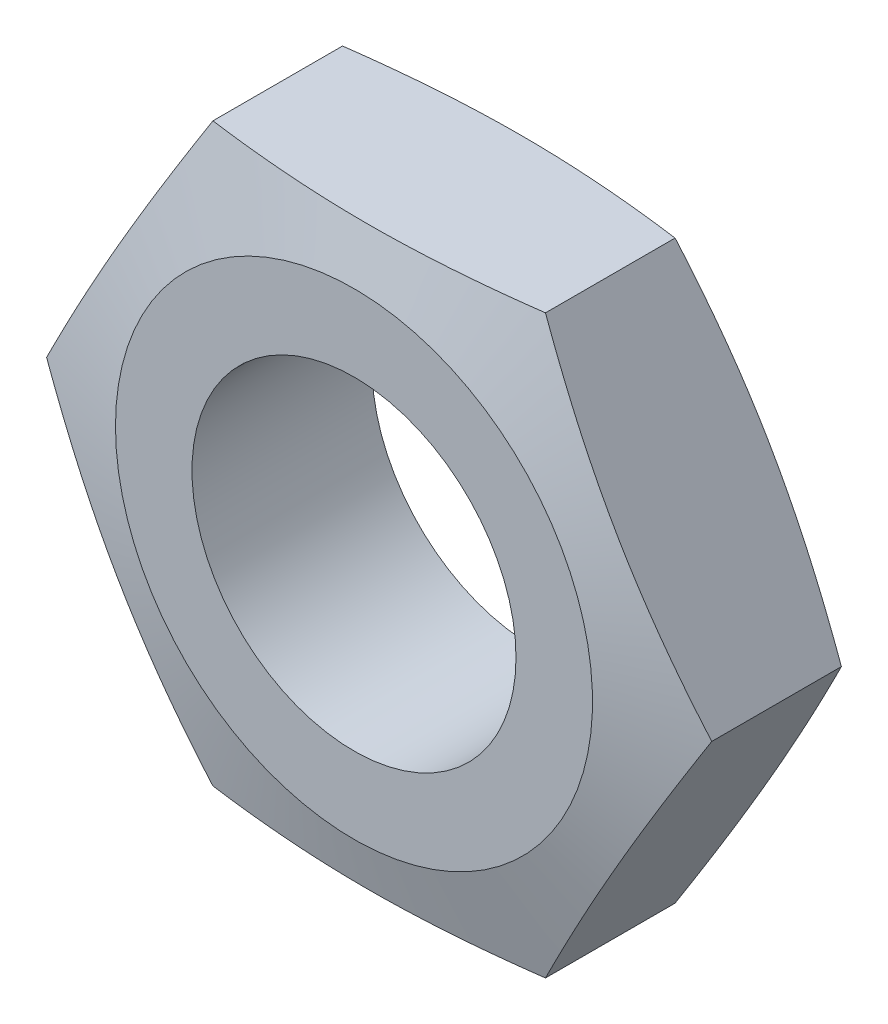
SolidWorks part; units mm, degrees
ref_plane "Plan1" through (0, 0, 0) normal (0, 0, 1) x (1, 0, 0)
ref_plane "Plan2" through (0, 0, 0) normal (0, 1, 0) x (1, 0, 0)
ref_plane "Plan3" through (0, 0, 0) normal (1, 0, 0) x (0, 0, -1)
sketch "Esquisse1" plane through (0, 0, 0) normal (0, 0, 1) x (1, 0, 0)
  line L0 (-4.6188, 8) -> (4.6188, 8)
  line L1 (4.6188, 8) -> (9.2376, 0)
  line L2 (9.2376, 0) -> (4.6188, -8)
  line L3 (4.6188, -8) -> (-4.6188, -8)
  line L4 (-4.6188, -8) -> (-9.2376, 0)
  line L5 (-9.2376, 0) -> (-4.6188, 8)
  circle A0 centre (0, 0) radius 9.2376 construction
  circle A1 centre (0, 0) radius 4.5
  dimension "D2" = 9
  dimension "D1" = 16
extrude "Base-Extrusion" add sketch "Esquisse1" against normal mid plane 5
sketch "Esquisse2" plane through (0, 0, 0) normal (0, 1, 0) x (1, 0, 0)
  line L0 (6.6252, 2.5) -> (9.2376, 1.8)
  line L1 (-4.6188, 2.5) -> (4.6188, 2.5) construction
  line L2 (9.2376, 2.5) -> (9.2376, -2.5) construction
  line L3 (9.2376, 1.8) -> (9.2376, 2.5)
  line L4 (9.2376, 2.5) -> (6.6252, 2.5)
  line L5 (0, 6.869) -> (0, -0.8568) construction
  line L6 (0, 2.5) -> (0, -2.5) construction
  dimension "D1" = 15
  dimension "D2" = 0.7
revolve "Enlever de la matière-Révolution1" cut sketch "Esquisse2" angle 360 about L5
mirror "Symétrie1" about plane through (0, 0, 0) normal (0, 0, 1)
